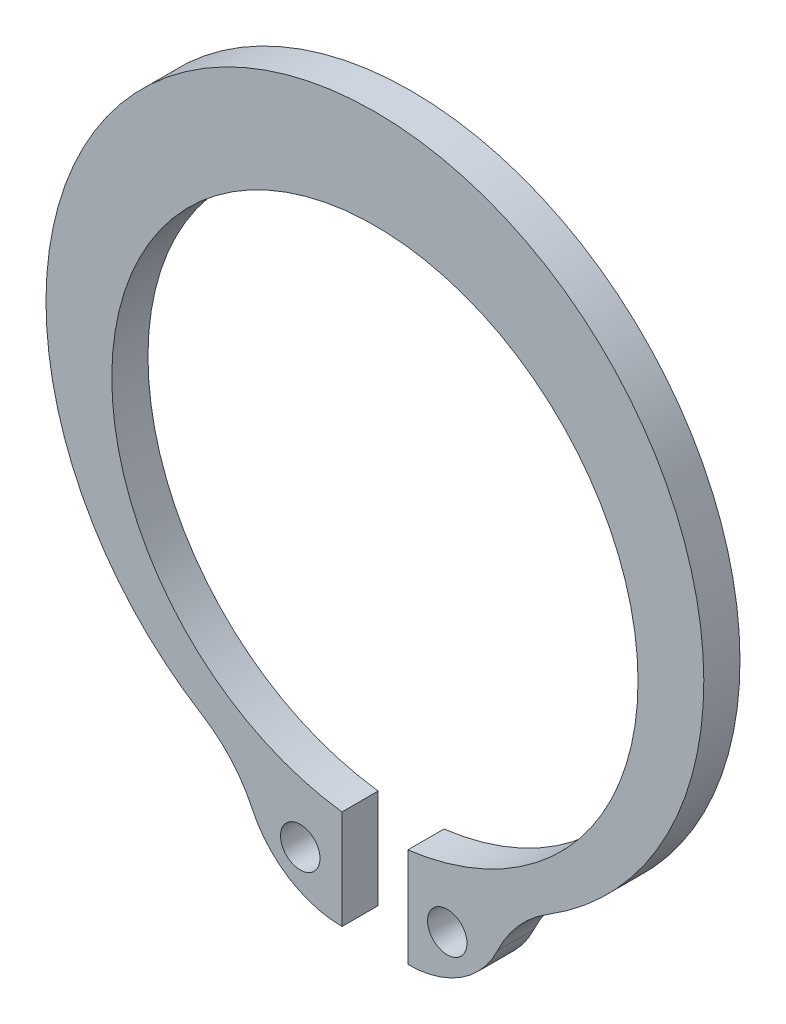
SolidWorks part; units mm, degrees
ref_plane "Face" through (0, 0, 0) normal (0, 0, 1) x (1, 0, 0)
ref_plane "Dessus" through (0, 0, 0) normal (0, 1, 0) x (1, 0, 0)
ref_plane "Droite" through (0, 0, 0) normal (1, 0, 0) x (0, 0, -1)
sketch "Esquisse1" plane through (0, 0, 0) normal (0, 0, 1) x (1, 0, 0)
  line L0 (-1, -7.9373) -> (-1, -10.9545)
  line L1 (1, -7.9373) -> (1, -10.9545)
  line L4 (-14.8617, 0) -> (20.588, 0) construction
  arc A0 (1, -7.9373) -> (-1, -7.9373) centre (0, 0) ccw
  arc A1 (5.2539, -7.5086) -> (-5.2539, -7.5086) centre (0, 1) ccw
  arc A3 (1, -10.9545) -> (3.7327, -9.2163) centre (1, -7.9373) ccw
  arc A4 (-3.7327, -9.2163) -> (-1, -10.9545) centre (-1, -7.9373) ccw
  arc A6 (3.7327, -9.2163) -> (5.2539, -7.5086) centre (7.3554, -10.9121) cw
  arc A7 (-3.7327, -9.2163) -> (-5.2539, -7.5086) centre (-7.3554, -10.9121) ccw
  circle A8 centre (2.2, -9.5) radius 0.6
  circle A9 centre (-2.27, -9.5) radius 0.6
  dimension "D1" = 16
  dimension "D2" = 20
  dimension "D3" = 1
  dimension "D8" = 1.2
  dimension "D9" = 2.2
  dimension "D7" = 4
  dimension "D10" = 9.5
  dimension "D11" = 1.2
  dimension "D12" = 4.47
  dimension "D4" = 1
  dimension "D5" = 2
extrude "Base-Extrusion" add sketch "Esquisse1" along normal blind 1.1
